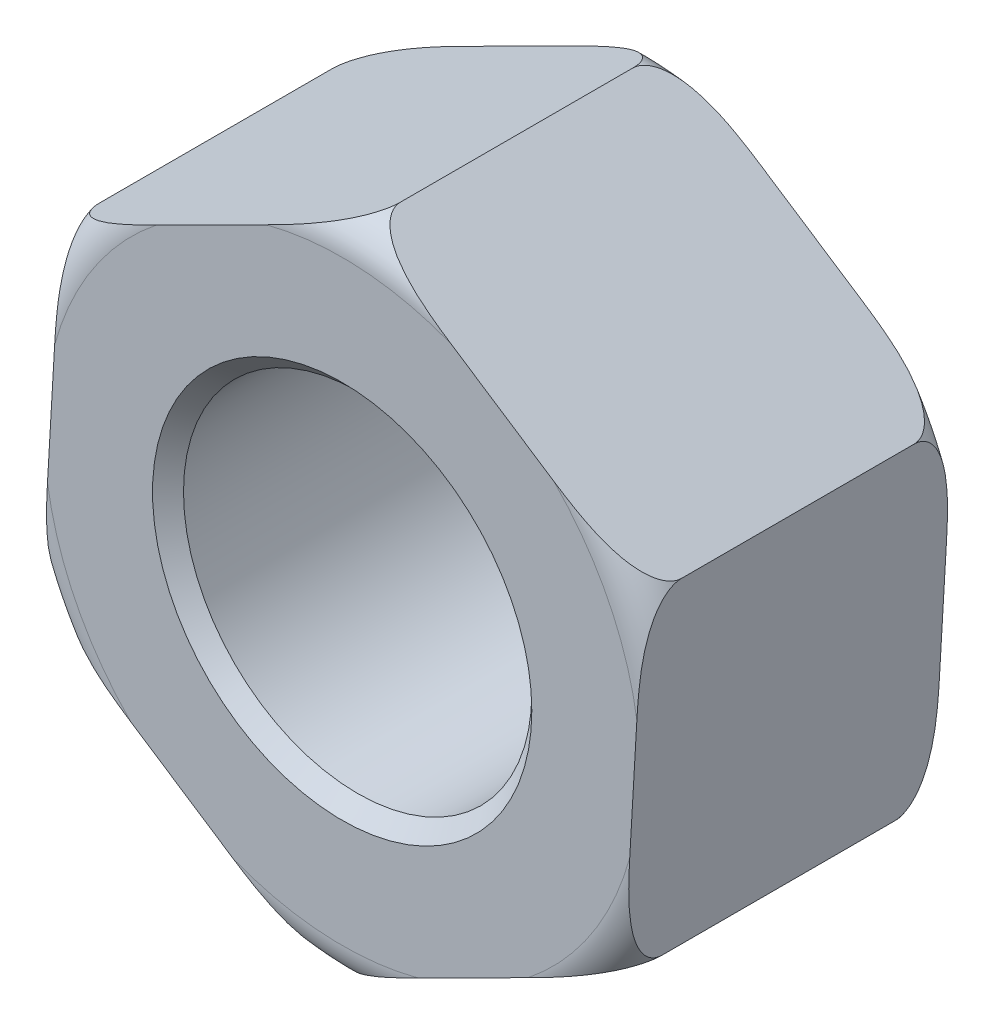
SolidWorks part; units mm, degrees
ref_plane "Plan de face" through (0, 0, 0) normal (0, 0, 1) x (1, 0, 0)
ref_plane "Plan de dessus" through (0, 0, 0) normal (0, 1, 0) x (1, 0, 0)
ref_plane "Plan de droite" through (0, 0, 0) normal (1, 0, 0) x (0, 0, -1)
sketch "Esquisse1" plane through (0, 0, 0) normal (0, 0, 1) x (1, 0, 0)
  circle A0 centre (0, 0) radius 4.35
  circle A1 centre (0, 0) radius 2.25
  dimension "D1" = 8.7
  dimension "D2" = 4.5
extrude "Extrusion1" add sketch "Esquisse1" along normal blind 4
fillet "Congé1" radius 0.5 2 edges at (4.35, 0, 0) (4.35, 0, 4)
sketch "Esquisse2" plane through (0, 0, 4) normal (0, 0, 1) x (1, 0, 0)
  line L3 (3.8871, 1.9527) -> (0.2525, 4.3427)
  line L4 (0.2525, 4.3427) -> (-3.6346, 2.39)
  line L5 (-3.6346, 2.39) -> (-3.8871, -1.9527)
  line L6 (-3.8871, -1.9527) -> (-0.2525, -4.3427)
  line L7 (-0.2525, -4.3427) -> (3.6346, -2.39)
  line L8 (3.6346, -2.39) -> (3.8871, 1.9527)
  circle A0 centre (0, 0) radius 4.35 construction
extrude "Enlèv. mat.-Extru.1" cut sketch "Esquisse2" against normal blind 4 flip side to cut
chamfer "Chanfrein1" distance 0.2 angle 45 2 edges at (2.25, 0, 0) (2.25, 0, 4)
